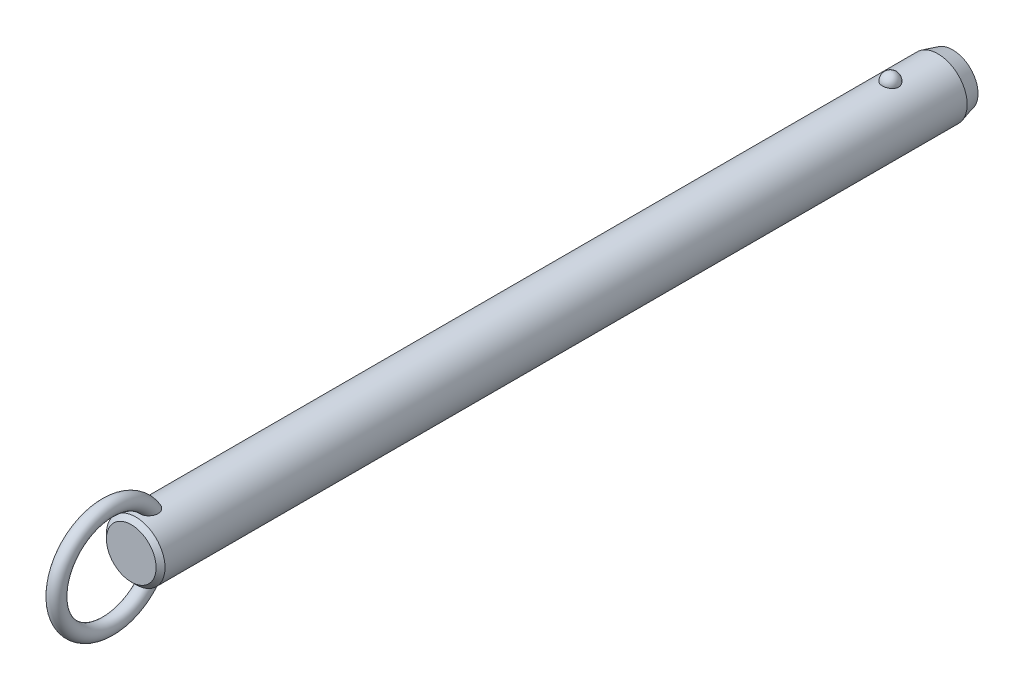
SolidWorks part; units mm, degrees
ref_plane "Front Plane" through (0, 0, 0) normal (0, 0, 1) x (1, 0, 0)
ref_plane "Top Plane" through (0, 0, 0) normal (0, 1, 0) x (1, 0, 0)
ref_plane "Right Plane" through (0, 0, 0) normal (1, 0, 0) x (0, 0, -1)
sketch "Sketch2" plane through (0, 0, 0) normal (0, 0, 1) x (1, 0, 0)
  circle A0 centre (0, 0) radius 7.9
  point P3 (0, 7.9)
  dimension "D1" = 15.8
extrude "Boss-Extrude1" add sketch "Sketch2" along normal blind 193
sketch "Sketch3" plane through (0, 0, 0) normal (0, 0, -1) x (-1, 0, 0)
  circle A0 centre (0, 0) radius 7.9
  dimension "D1" = 15.8
extrude "Boss-Extrude2" add sketch "Sketch3" along normal blind 19
chamfer "Chamfer1" distance 4 angle 15 1 edges at (-7.9, 0, -19)
sketch "Sketch12" plane through (0, 0, 0) normal (1, 0, 0) x (0, 0, -1)
  line L0 (-193, 7.9) -> (-193, -7.9) construction
  point P0 (-193, 0)
sketch "Sketch13" plane through (0, 0, 0) normal (1, 0, 0) x (0, 0, -1)
  circle A0 centre (-208.85, 0) radius 15.85
  point P2 (-193, 0)
  dimension "D1" = 31.7
sketch "Sketch14" plane through (0, 0, 0) normal (0, 1, 0) x (1, 0, 0)
  circle A0 centre (0, -195) radius 2
  point P2 (0, -193)
  dimension "D1" = 4
sweep "Sweep1" add profiles "Sketch14" path "Sketch13"
sketch "Sketch15" plane through (0, 0, 193) normal (0, 0, 1) x (1, 0, 0)
  circle A0 centre (0, 0) radius 7.9
  dimension "D1" = 15.8
extrude "Boss-Extrude3" add sketch "Sketch15" along normal blind 9.52
chamfer "Chamfer2" distance 1.2 angle 45 1 edges at (7.9, 0, 202.52)
sketch "Sketch18" plane through (0, 0, 0) normal (1, 0, 0) x (0, 0, -1)
  line L0 (15, 7.9) -> (-195.1091, 7.9) construction
  line L1 (2.2, 10.1) -> (2.2, 5.7)
  line L2 (-195.1091, -7.9) -> (15, -7.9) construction
  arc A0 (2.2, 10.1) -> (2.2, 5.7) centre (2.2, 7.9) ccw
  point P4 (0, 7.9)
  dimension "D1" = 18
revolve "Revolve1" add sketch "Sketch18" angle 360 about L1
